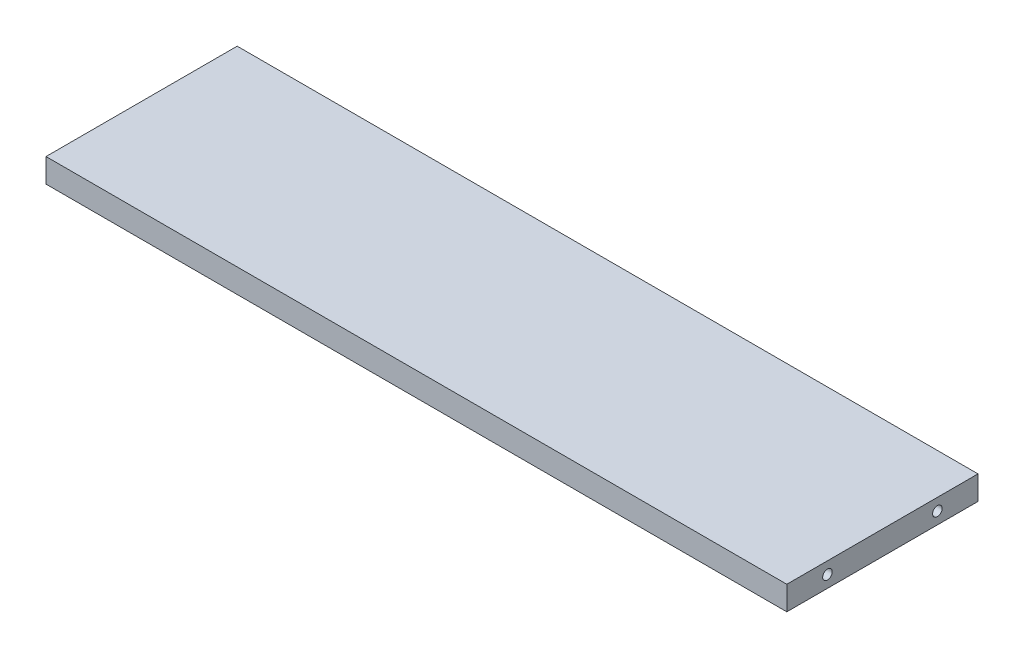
SolidWorks part; units mm, degrees
ref_plane "Plan de face" through (0, 0, 0) normal (0, 0, 1) x (1, 0, 0)
ref_plane "Plan de dessus" through (0, 0, 0) normal (0, 1, 0) x (1, 0, 0)
ref_plane "Plan de droite" through (0, 0, 0) normal (1, 0, 0) x (0, 0, -1)
sketch "Esquisse1" plane through (0, 0, 0) normal (0, 0, 1) x (1, 0, 0)
  line L0 (150, 24.4756) -> (150, -13.189) construction
  line L1 (0, 0) -> (310, 0)
  line L2 (0, 0) -> (0, 10)
  line L3 (0, 10) -> (310, 10)
  line L4 (310, 0) -> (310, 10)
  dimension "D1" = 310
  dimension "D2" = 10
extrude "Extrusion1" add sketch "Esquisse1" against normal blind 80
sketch "Esquisse2" plane through (310, 0, 0) normal (1, 0, 0) x (0, 0, -1)
  line L0 (9.181, 5) -> (92.4232, 5) construction
  line L1 (40, 12.819) -> (40, -4.3828) construction
  line L2 (0, 0) -> (0, 10) construction
  line L3 (80, 10) -> (0, 10) construction
  circle A0 centre (17, 5) radius 2
  circle A1 centre (63, 5) radius 2
  dimension "D1" = 4
  dimension "D2" = 17
  dimension "D3" = 5
extrude "Enlèv. mat.-Extru.1" cut sketch "Esquisse2" against normal blind 10
sketch "Esquisse7" plane through (0, 0, 0) normal (-1, 0, 0) x (0, 0, 1)
  line L0 (-76.2321, 5) -> (7.371, 5) construction
  line L1 (-40, 12.6386) -> (-40, -2.398) construction
  line L2 (-80, 10) -> (-80, 0) construction
  circle A0 centre (-63, 5) radius 2
  circle A1 centre (-17, 5) radius 2
  dimension "D1" = 4
  dimension "D2" = 17
extrude "Enlèv. mat.-Extru.2" cut sketch "Esquisse7" against normal blind 10
